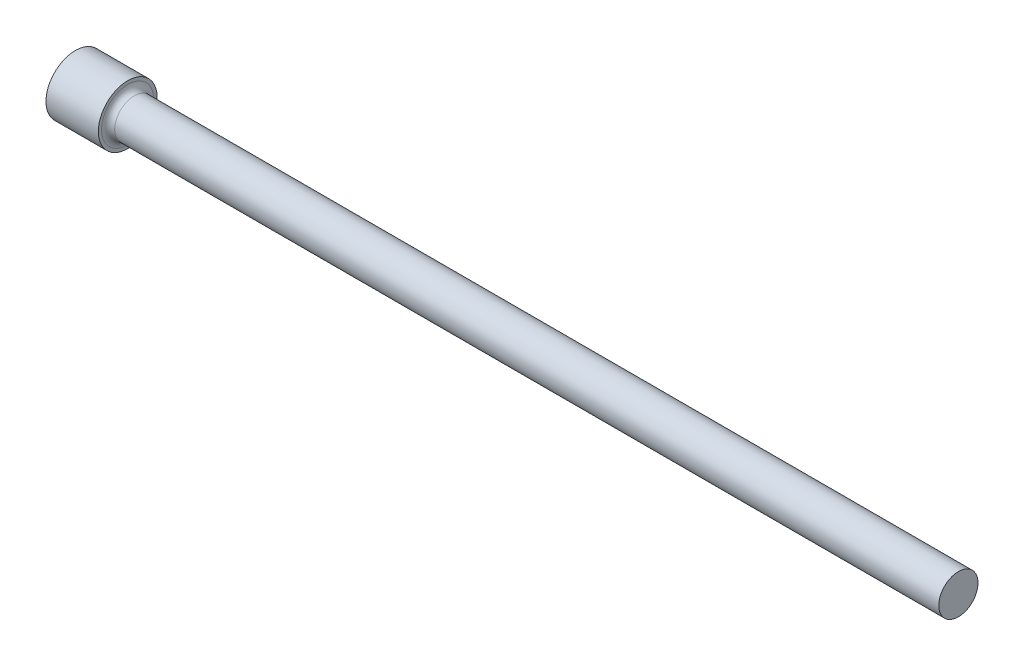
SolidWorks part; units mm, degrees
ref_plane "Front" through (0, 0, 0) normal (0, 0, 1) x (1, 0, 0)
ref_plane "Top" through (0, 0, 0) normal (0, 1, 0) x (1, 0, 0)
ref_plane "Right" through (0, 0, 0) normal (1, 0, 0) x (0, 0, -1)
imported_body "712-3-80"
sketch "Esquisse1" plane through (0, 0, 0) normal (0, 0, 1) x (1, 0, 0)
  line L0 (67.5, -28.1903) -> (67.5, 48.1342)
  line L1 (67.5, 18.5011) -> (67.5, -3.5011) construction
extrude "Enlèv. mat.-Extru.1" cut sketch "Esquisse1" against normal through all and the other way through all flip side to cut
